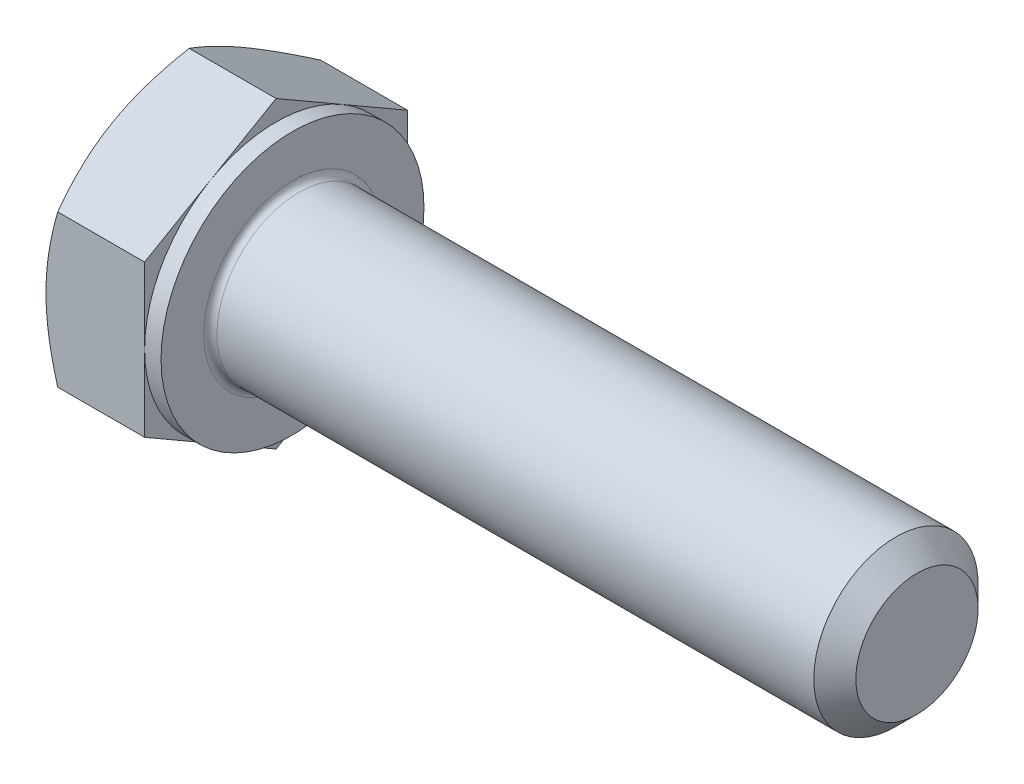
SolidWorks part; units mm, degrees
extrude "基体-拉伸" add sketch "草图1" along normal blind 3.5
sketch "草图1" plane through (0, 0, 0) normal (1, 0, 0) x (0, 0, -1)
  line L0 (4, 2.3094) -> (4, -2.3094)
  line L1 (-4, 2.3094) -> (-4, -2.3094)
  line L2 (4, -2.3094) -> (0, -4.6188)
  line L3 (0, -4.6188) -> (-4, -2.3094)
  line L4 (4, 2.3094) -> (0, 4.6188)
  line L5 (0, 4.6188) -> (-4, 2.3094)
revolve "切除-旋转1" cut sketch "草图3" angle 360 about L6
sketch "草图3" plane through (0, 0, 0) normal (0, 0, 1) x (1, 0, 0)
  line L0 (0, 4) -> (3.244, 9.6188)
  line L1 (0, 4.6188) -> (0, 2.3094) construction
  line L2 (3.244, 9.6188) -> (3.244, 14.6188)
  line L3 (3.244, 14.6188) -> (-10, 14.6188)
  line L4 (-10, 14.6188) -> (-10, 4)
  line L5 (-10, 4) -> (0, 4)
  line L6 (0, 0) -> (99.06, 0) construction
  line L7 (3.5, 4.6188) -> (0, 4.6188) construction
revolve "凸台-旋转1" add sketch "草图2" angle 360 about L7
sketch "草图2" plane through (0, 0, 0) normal (0, 0, 1) x (1, 0, 0)
  line L0 (0, 2.3094) -> (0, -2.3094) construction
  line L1 (0, 0) -> (22.5, 0)
  line L2 (0, 0) -> (0, 2.5)
  line L3 (0, 2.5) -> (22.5, 2.5)
  line L4 (22.5, 0) -> (22.5, 1.8072)
  line L5 (3.5, 4.6188) -> (3.5, 2.3094) construction
  line L7 (0, 0) -> (96.52, 0) construction
  line L8 (22.5, -1.8072) -> (90.335, -2.5) construction
  line L9 (0, -2.5) -> (90.335, -2.5) construction
  line L10 (4.3, 15.24) -> (4.3, -1.27) construction
  line L11 (3.5, 15.24) -> (3.5, -1.27) construction
  line L12 (3.5, 2.3094) -> (3.5, -2.3094) construction
  line L14 (22.5, 2.5) -> (22.5, 1.8072)
  dimension "l" = 19
  dimension "m" = 5
  dimension "Minor_dia" = 3.6144
  dimension "p" = 0.8
  dimension "h" = 19
ref_plane "前视" through (0, 0, 0) normal (0, 0, 1) x (1, 0, 0)
ref_plane "上视" through (0, 0, 0) normal (0, 1, 0) x (1, 0, 0)
ref_plane "右视" through (0, 0, 0) normal (1, 0, 0) x (0, 0, -1)
sketch "草图5" plane through (0, 0, 0) normal (0, 0, 1) x (1, 0, 0)
  line L0 (3.5, 4) -> (0.256, 9.6188)
  line L1 (3.5, 4.6188) -> (3.5, 2.3094) construction
  line L2 (0.256, 9.6188) -> (0.256, 14.6188)
  line L3 (0.256, 14.6188) -> (10.256, 14.6188)
  line L4 (10.256, 14.6188) -> (10.256, 4)
  line L5 (10.256, 4) -> (3.5, 4)
  line L7 (3.5, 4.6188) -> (0.3573, 4.6188) construction
  line L8 (0, 0) -> (99.06, 0) construction
  line L9 (0, 0) -> (99.06, 0) construction
revolve "切除-旋转2" cut sketch "草图5" angle 360 about L8
sketch "草图4" plane through (0, 0, 0) normal (0, 0, 1) x (1, 0, 0)
  line L1 (3.5, 4.6188) -> (3.5, 2.3094) construction
  line L2 (3.5, 4) -> (3, 4)
  line L3 (3.5, 4) -> (3.5, 14.6188)
  line L4 (3.5, 14.6188) -> (3, 14.6188)
  line L5 (0, 0) -> (95.25, 0) construction
  line L6 (0, 0) -> (96.52, 0) construction
  line L7 (3, 4) -> (3, 14.6188)
  line L8 (3.1427, 4.6188) -> (0.3573, 4.6188) construction
revolve "切除-旋转3" cut sketch "草图4" angle 360 about L5
chamfer "倒角" distance 0.64 angle 45 1 edges at (22.5, 0, 2.5)
fillet "圆角" radius 0.2 1 edges at (3.5, 0, -2.5)
sketch "草图6" plane through (0, 0, 0) normal (0, 0, 1) x (1, 0, 0)
  line L0 (4.1, -1.8072) -> (3.7, -2.5)
  line L1 (4.1, -1.8072) -> (4.5, -2.5)
  line L2 (4.5, -2.5) -> (4.5, -3.125)
  line L3 (-3.175, 0) -> (5.1513, 0) construction
  line L5 (4.5, -3.125) -> (3.7, -3.125)
  line L6 (3.7, -3.125) -> (3.7, -2.5)
  arc A0 (3.7, -2.5) -> (3.5, -2.7) centre (3.7, -2.7) ccw construction
revolve "切除-旋转4" [suppressed] cut sketch "草图6" angle 360 about L3
pattern_linear "阵列(线性)1" [suppressed]
equation "\"D3@草图1\" = \"s@草图1\" / 2"
equation "\"D4@草图1\" = \"D3@草图1\""
equation "\"D5@草图1\" = \"D4@草图1\""
equation "\"D1@草图3\" = \"s@草图1\" / 2"
equation "\"D1@草图5\" = \"s@草图1\" / 2"
equation "\"Head_ch_ang@草图5\" = \"Head_ch_ang@草图3\""
equation "\"D1@草图4\" = \"s@草图1\""
equation "\"Diameter@草图6\" = \"m@草图2\""
equation "\"Overcut@草图6\" = \"m@草图2\" * 1.25"
equation "\"Minor_dia@草图2\" = \"m@草图2\"-\"p@草图2\" * 1.732"
equation "\"Thread_minor@螺旋线1\" = \"Minor_dia@草图2\""
equation "\"Thread_minor@草图6\" = \"Minor_dia@草图2\""
equation "\"D1@倒角\" = \"p@草图2\"*0.8"
equation "\"Thread_length@螺旋线1\" = \"l@草图2\" - \"p@草图2\""
equation "\"Num_threads@阵列(线性)1\" = \"l@草图2\" / \"p@草图2\""
